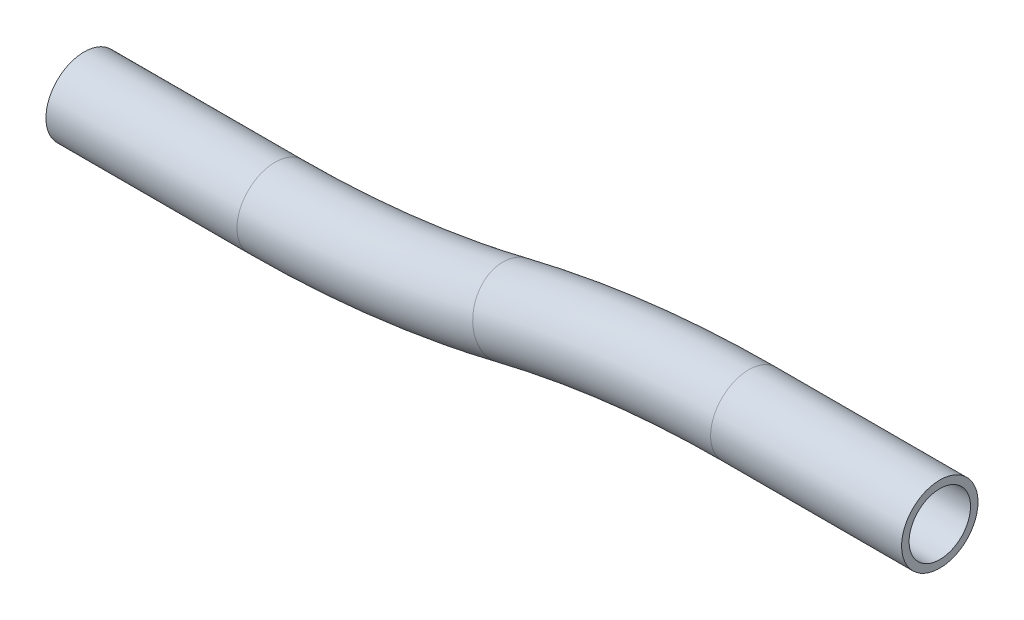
SolidWorks part; units mm, degrees
ref_plane "Front Plane" through (0, 0, 0) normal (0, 0, 1) x (1, 0, 0)
ref_plane "Top Plane" through (0, 0, 0) normal (0, 1, 0) x (1, 0, 0)
ref_plane "Right Plane" through (0, 0, 0) normal (1, 0, 0) x (0, 0, -1)
sketch "Sketch1" plane through (0, 0, 0) normal (1, 0, 0) x (0, 0, -1)
  circle A0 centre (0, 0) radius 5.1054
  circle A1 centre (0, 0) radius 6.35
  dimension "D1" = 12.7
  dimension "D2" = 10.2108
sketch "Sketch2" plane through (0, 0, 0) normal (0, 0, 1) x (1, 0, 0)
  line L0 (0, 0) -> (31.75, 0)
  line L1 (110.49, 9.4901) -> (142.24, 9.4901)
  arc A0 (31.75, 0) -> (71.12, 4.745) centre (31.75, 165.7011) ccw
  arc A1 (71.12, 4.745) -> (110.49, 9.4901) centre (110.49, -156.211) cw
  dimension "D3" = 165.7011
  dimension "D1" = 31.75
  dimension "D2" = 142.5562
  dimension "D4" = 142.24
  dimension "D5" = 9.4901
sweep "Sweep1" add profiles "Sketch1" path "Sketch2"
